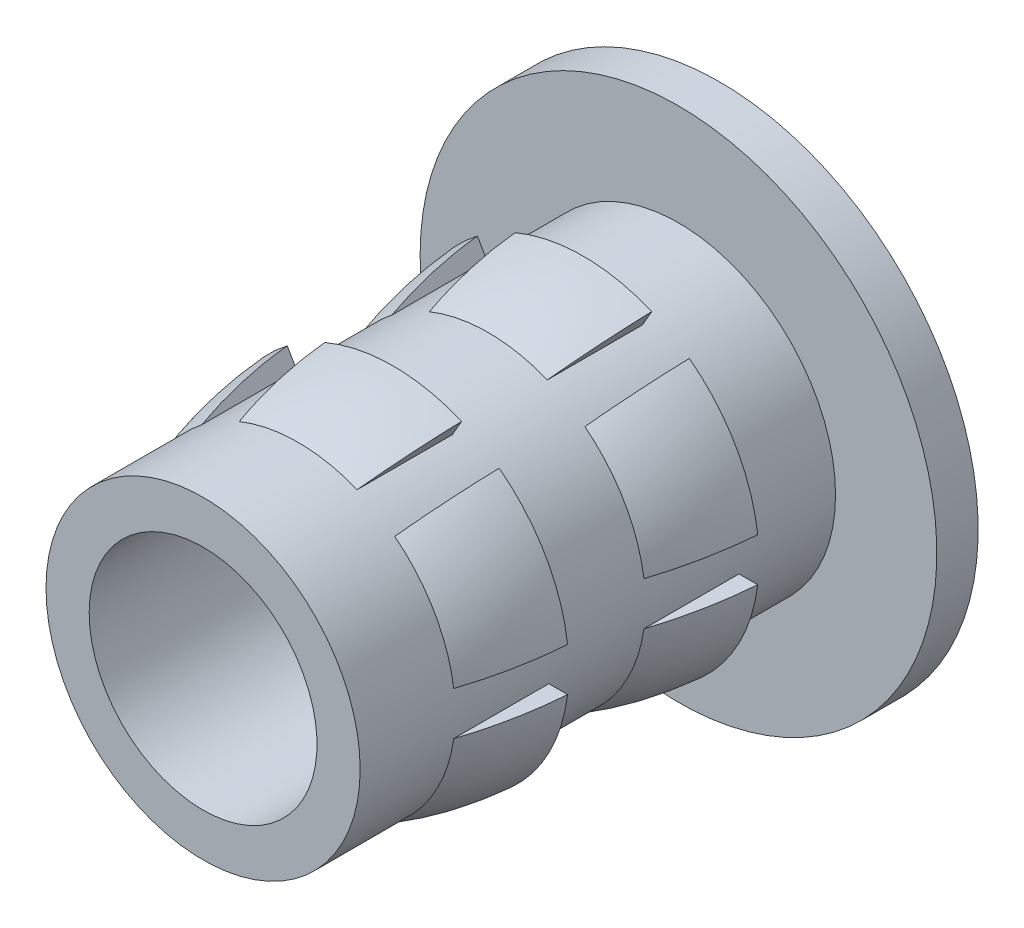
SolidWorks part; units mm, degrees
other "<flanged insert M5X0.8>-<M5x0.8 Tapped Hole1>"
ref_plane "Front Plane" through (0, 0, 0) normal (0, 0, 1) x (1, 0, 0)
ref_plane "Top Plane" through (0, 0, 0) normal (0, 1, 0) x (1, 0, 0)
ref_plane "Right Plane" through (0, 0, 0) normal (1, 0, 0) x (0, 0, -1)
inserted part "flanged insert M5X0.8"
